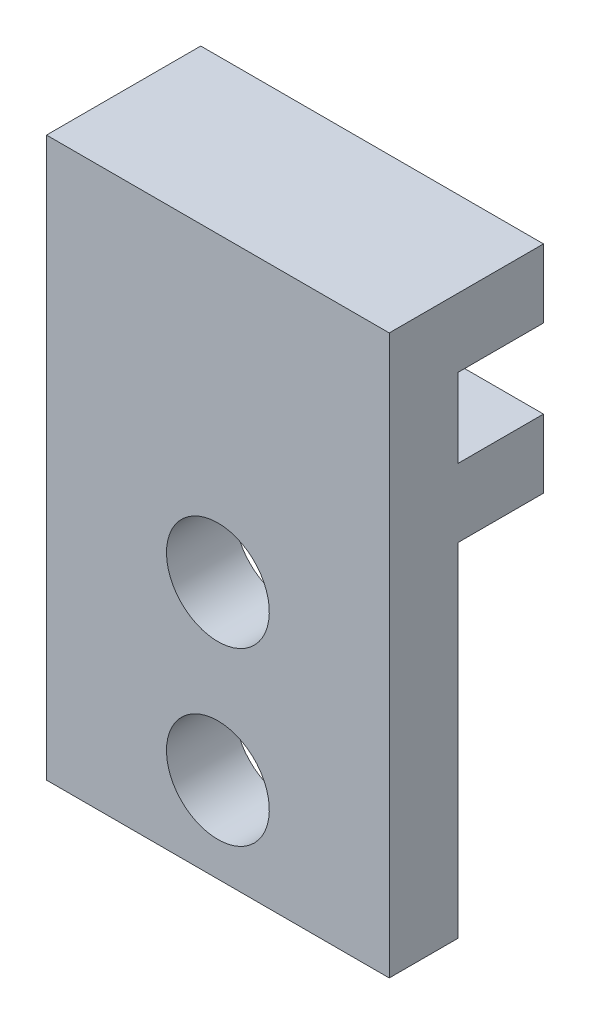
SolidWorks part; units mm, degrees
ref_plane "Plan de face" through (0, 0, 0) normal (0, 0, 1) x (1, 0, 0)
ref_plane "Plan de dessus" through (0, 0, 0) normal (0, 1, 0) x (1, 0, 0)
ref_plane "Plan de droite" through (0, 0, 0) normal (1, 0, 0) x (0, 0, -1)
sketch "Esquisse2" plane through (0, 0, 0) normal (1, 0, 0) x (0, 0, -1)
  line L0 (0, 0) -> (9, 0)
  line L1 (9, 0) -> (9, -4)
  line L2 (9, -4) -> (4, -4)
  line L3 (4, -4) -> (4, -8.6)
  line L4 (4, -8.6) -> (9, -8.6)
  line L5 (9, -8.6) -> (9, -12.6)
  line L6 (9, -12.6) -> (4, -12.6)
  line L7 (4, -12.6) -> (4, -32.6)
  line L8 (4, -32.6) -> (0, -32.6)
  line L9 (0, -32.6) -> (0, 0)
  point P9 (0, 0)
  point P12 (8.0137, -11.41)
  point P13 (4.5532, -8)
  point P14 (7.6933, -12)
  dimension "D1" = 4.6
  dimension "D2" = 4
  dimension "D3" = 4
  dimension "D4" = 5
  dimension "D5" = 20
extrude "Boss.-Extru.1" add sketch "Esquisse2" along normal blind 20
sketch "Esquisse3" plane through (0, 0, -4) normal (0, 0, -1) x (-1, 0, 0)
  line L0 (-10, -27.6) -> (-10, -17.6) construction
  line L1 (0, -32.6) -> (0, -12.6) construction
  line L2 (-20, -32.6) -> (0, -32.6) construction
  circle A0 centre (-10, -17.6) radius 3
  circle A1 centre (-10, -27.6) radius 3
  point P6 (0, -22.6)
  point P7 (-10, -22.6)
  point P10 (-10, -32.6)
  dimension "D1" = 6
  dimension "D2" = 10
extrude "Enlèv. mat.-Extru.1" cut sketch "Esquisse3" against normal through all
